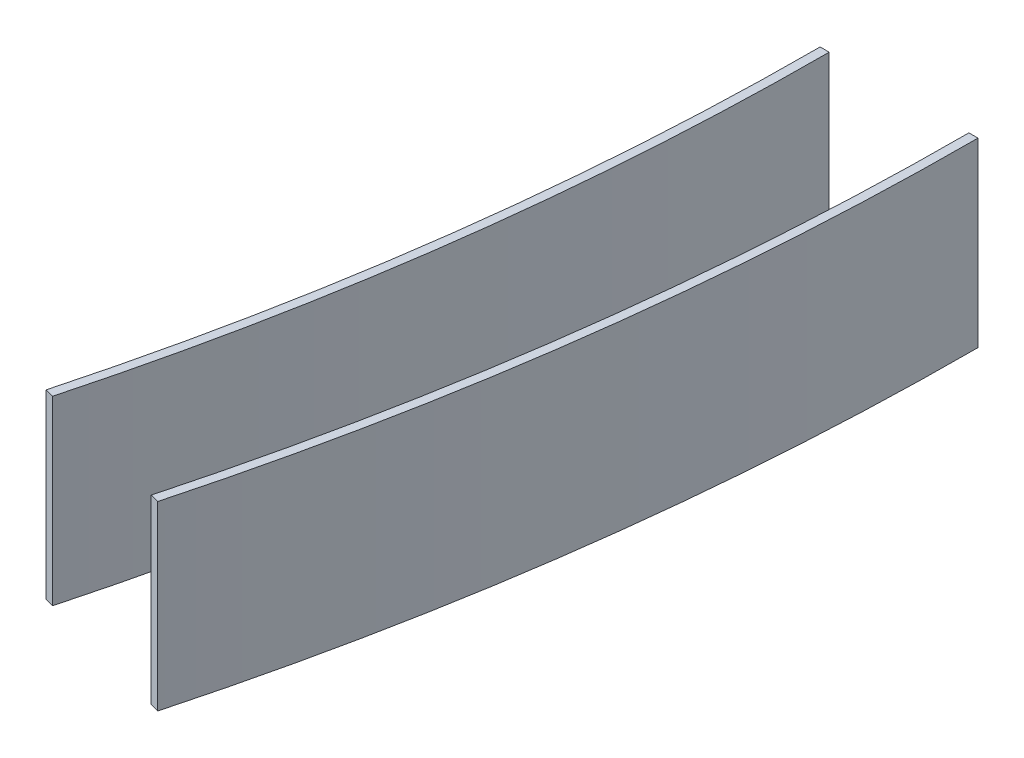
SolidWorks part; units mm, degrees
ref_plane "Спереди" through (0, 0, 0) normal (0, 0, 1) x (1, 0, 0)
ref_plane "Сверху" through (0, 0, 0) normal (0, 1, 0) x (1, 0, 0)
ref_plane "Справа" through (0, 0, 0) normal (1, 0, 0) x (0, 0, -1)
sketch "Эскиз1" plane through (0, 0, 0) normal (0, 0, 1) x (1, 0, 0)
  line L52 (146.15, 0.25) -> (146.15, -9.75)
  line L65 (0, 44.1102) -> (0, 0) construction
  line L75 (150, 12.0049) -> (150, -5.7785) construction
  line L80 (153.85, 0.25) -> (153.85, -9.75)
  line L89 (145.65, 0.25) -> (146.15, 0.25)
  line L91 (145.65, 0.25) -> (145.65, -9.75)
  line L93 (146.15, 0.25) -> (146.15, -9.75)
  line L95 (153.85, -9.75) -> (153.85, 0.25)
  line L97 (154.35, -9.75) -> (154.35, 0.25)
  line L98 (153.85, 0.25) -> (154.35, 0.25)
  line L99 (154.35, -9.75) -> (153.85, -9.75)
  line L100 (146.15, -9.75) -> (145.65, -9.75)
  dimension "D7" = 10
revolve "Повернуть1" add sketch "Эскиз1" angle 15 about L65
